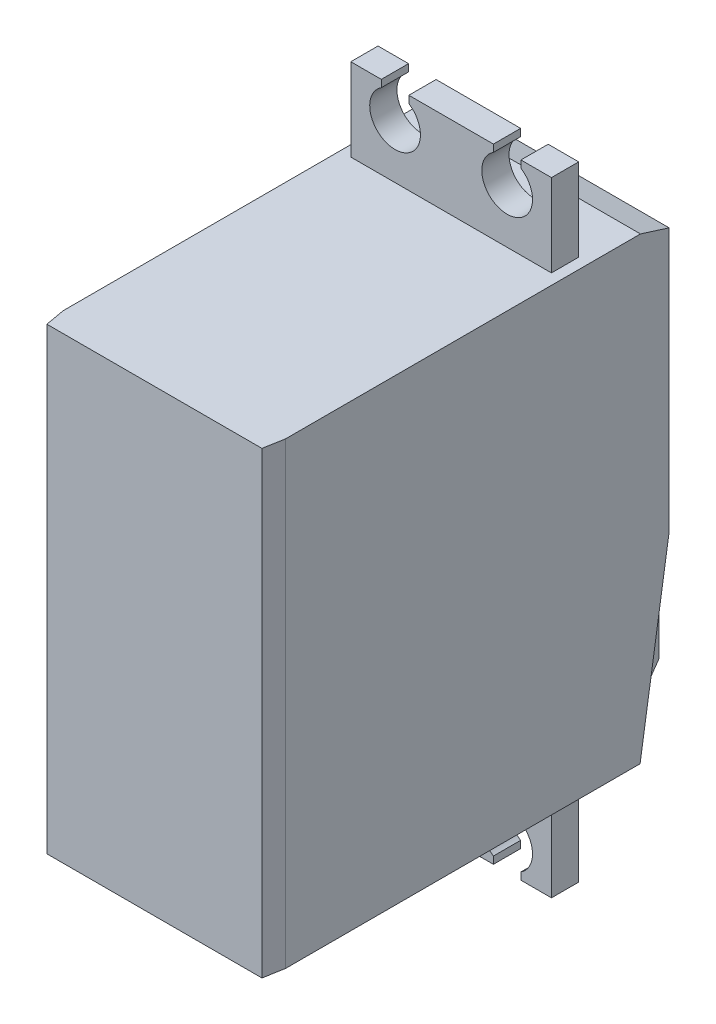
SolidWorks part; units mm, degrees
ref_plane "Front Plane" through (0, 0, 0) normal (0, 0, 1) x (1, 0, 0)
ref_plane "Top Plane" through (0, 0, 0) normal (0, 1, 0) x (1, 0, 0)
ref_plane "Right Plane" through (0, 0, 0) normal (1, 0, 0) x (0, 0, -1)
sketch "Sketch1" plane through (0, 0, 0) normal (0, 0, 1) x (1, 0, 0)
  line L0 (0, 0) -> (0, 11.6439) construction
  line L1 (-9.8425, 20.32) -> (9.8425, 20.32)
  line L2 (-9.8425, 20.32) -> (-9.8425, -20.32)
  line L3 (-9.8425, -20.32) -> (9.8425, -20.32)
  line L4 (9.8425, 20.32) -> (9.8425, -20.32)
  line L5 (0, 0) -> (6.8718, 0) construction
  dimension "D1" = 40.64
  dimension "D2" = 19.685
extrude "Extrude1" add sketch "Sketch1" along normal blind 35.7632
chamfer "Chamfer1" distance 1.778 angle 10 1 edges at (9.8425, 0, 35.7632)
chamfer "Chamfer2" distance 1.778 angle 10 1 edges at (-9.8425, 0, 35.7632)
chamfer "Chamfer3" distance 16.51 angle 8.85 1 edges at (0, -20.32, 0)
sketch "Sketch2" plane through (0, 0, 0) normal (0, 0, -1) x (-1, 0, 0)
  line L0 (0, 0) -> (0, -14.6656) construction
  line L1 (-9.8425, 20.32) -> (9.8425, 20.32) construction
  line L2 (-8.9535, -2.54) -> (8.9535, -2.54)
  line L3 (-8.9535, -2.54) -> (-8.9535, -17.272)
  line L4 (-8.9535, -17.272) -> (8.9535, -17.272)
  line L5 (8.9535, -2.54) -> (8.9535, -17.272)
  dimension "D1" = 14.732
  dimension "D2" = 17.907
  dimension "D3" = 22.86
extrude "Extrude2" add sketch "Sketch2" against normal up to next
chamfer "Chamfer4" distance 3.302 angle 35 1 edges at (0, -17.272, 0)
sketch "Sketch3" plane through (0, 0, 0) normal (0, 0, -1) x (-1, 0, 0)
  line L0 (-9.8425, 20.32) -> (9.8425, 20.32) construction
  line L1 (0, 0) -> (0, -4.4447) construction
  line L2 (0, 0) -> (0, 9.4615) construction
  circle A0 centre (0, 9.4615) radius 7.1755
  dimension "D1" = 14.351
  dimension "D2" = 10.8585
extrude "Extrude3" add sketch "Sketch3" along normal blind 1.6256
chamfer "Chamfer5" distance 2.54 angle 17.5 1 edges at (0, 20.32, 0)
chamfer "Chamfer6" distance 1.6256 distance2 2.0955 1 edges at (-7.1755, 9.4615, -1.6256)
sketch "Sketch4" plane through (0, 0, -1.6256) normal (0, 0, -1) x (-1, 0, 0)
  line L0 (0, 14.5415) -> (0, 4.3815) construction
  line L1 (-5.08, 9.4615) -> (5.08, 9.4615) construction
  circle A0 centre (0, 9.4615) radius 5.08 construction
  circle A1 centre (0, 9.4615) radius 2.9591
  dimension "D1" = 5.9182
extrude "Cut-Extrude1" cut sketch "Sketch4" against normal blind 10
sketch "Sketch5" plane through (0, 20.32, 0) normal (0, 1, 0) x (1, 0, 0)
  line L0 (0, -2.54) -> (0, -21.7911) construction
  line L1 (-8.89, -7.0612) -> (8.89, -7.0612)
  line L2 (-8.89, -7.0612) -> (-8.89, -9.4742)
  line L3 (-8.89, -9.4742) -> (8.89, -9.4742)
  line L4 (8.89, -7.0612) -> (8.89, -9.4742)
  line L5 (9.8425, -2.54) -> (-9.8425, -2.54) construction
  line L6 (9.529, -35.7632) -> (-9.529, -35.7632) construction
  dimension "D1" = 2.413
  dimension "D2" = 17.78
  dimension "D3" = 26.289
extrude "Extrude4" add sketch "Sketch5" along normal blind 7.3152
sketch "Sketch6" plane through (0, 0, 7.0612) normal (0, 0, -1) x (-1, 0, 0)
  line L0 (-9.8425, 20.32) -> (9.8425, 20.32) construction
  line L1 (-8.89, 27.6352) -> (-8.89, 20.32) construction
  line L2 (0, 27.6352) -> (0, 20.32) construction
  line L3 (-8.89, 27.6352) -> (8.89, 27.6352) construction
  line L4 (-4.9657, 25.1079) -> (-4.9657, 27.6352) construction
  line L5 (-6.1849, 27.6352) -> (-3.7465, 27.6352)
  line L6 (-6.1849, 27.6352) -> (-6.1849, 26.9964)
  line L7 (-8.89, 20.32) -> (8.89, 20.32) construction
  line L8 (-3.7465, 27.6352) -> (-3.7465, 26.9964)
  line L9 (4.9657, 25.1079) -> (4.9657, 27.6352) construction
  line L10 (3.7465, 27.6352) -> (6.1849, 27.6352)
  line L11 (3.7465, 27.6352) -> (3.7465, 26.9964)
  line L13 (6.1849, 27.6352) -> (6.1849, 26.9964)
  arc A0 (-6.1849, 26.9964) -> (-3.7465, 26.9964) centre (-4.9657, 25.1079) ccw
  arc A1 (3.7465, 26.9964) -> (6.1849, 26.9964) centre (4.9657, 25.1079) ccw
  dimension "D1" = 4.4958
  dimension "D4" = 9.9314
  dimension "D2" = 4.7879
  dimension "D3" = 3.9243
  dimension "D5" = 2.4384
extrude "Cut-Extrude2" cut sketch "Sketch6" against normal up to next
sketch "Sketch8" plane through (0, 0, 7.0612) normal (0, 0, -1) x (-1, 0, 0)
  line L0 (0, 20.32) -> (0, 27.6352) construction
  line L1 (-8.89, 20.32) -> (8.89, 20.32) construction
  line L2 (-3.7465, 27.6352) -> (3.7465, 27.6352) construction
  line L4 (-0.9525, 20.32) -> (0.9525, 20.32)
  line L5 (-0.9525, 20.32) -> (-0.9525, 24.13)
  line L6 (-0.9525, 24.13) -> (0.9525, 24.13)
  line L7 (0.9525, 20.32) -> (0.9525, 24.13)
  dimension "D1" = 1.905
  dimension "D2" = 3.81
extrude "Extrude5" add sketch "Sketch8" along normal blind 0.8636
ref_plane "Plane1" through (0, 0, 0) normal (0, 1, 0) x (-1, 0, 0)
mirror "Mirror1" about plane through (0, 0, 0) normal (0, 1, 0) of "Extrude5", "Cut-Extrude2", "Extrude4"
